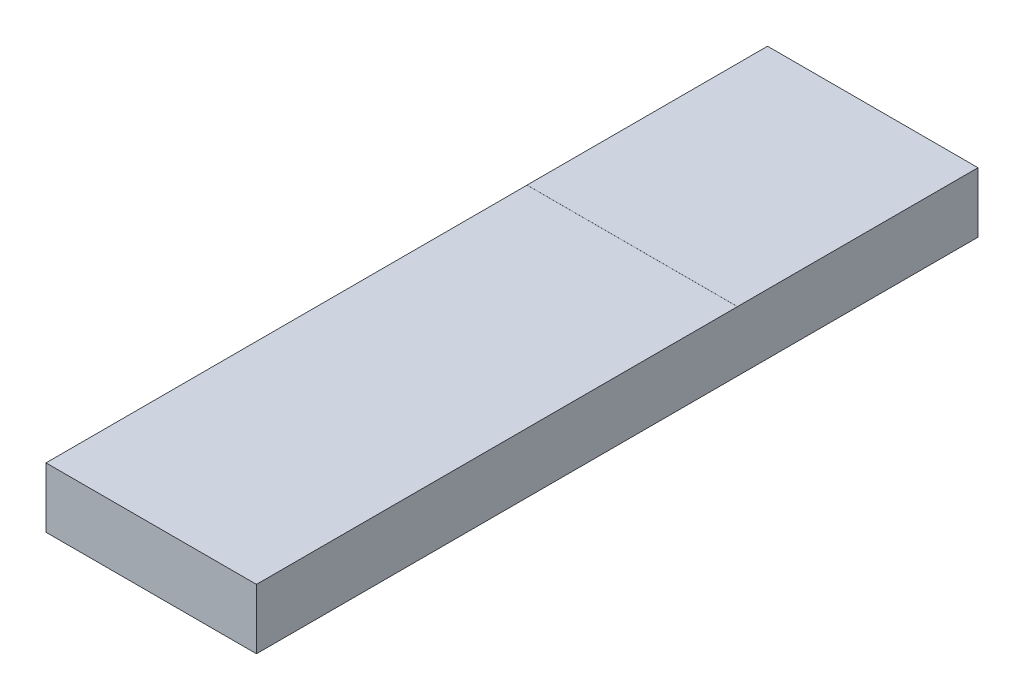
SolidWorks part; units mm, degrees
ref_plane "Plan de face" through (0, 0, 0) normal (0, 0, 1) x (1, 0, 0)
ref_plane "Plan de dessus" through (0, 0, 0) normal (0, 1, 0) x (1, 0, 0)
ref_plane "Plan de droite" through (0, 0, 0) normal (1, 0, 0) x (0, 0, -1)
sketch "Esquisse1" plane through (0, 0, 0) normal (0, 0, 1) x (1, 0, 0)
  line L1 (0, 0) -> (350, 0)
  line L2 (0, 0) -> (0, 100)
  line L3 (0, 100) -> (350, 100)
  line L4 (350, 0) -> (350, 100)
  dimension "D1" = 350
  dimension "D2" = 100
extrude "Boss.-Extru.1" add sketch "Esquisse1" along normal blind 1200
sketch "Esquisse2" plane through (0, 100, 0) normal (0, 1, 0) x (1, 0, 0)
  line L0 (0, -1200) -> (0, 0) construction
  line L1 (350, 0) -> (0, 0)
  line L2 (350, 0) -> (350, -400)
  line L3 (350, -400) -> (0, -400)
  line L4 (0, 0) -> (0, -400)
  dimension "D1" = 400
extrude "Boss.-Extru.2" add sketch "Esquisse2" along normal blind 0.1
